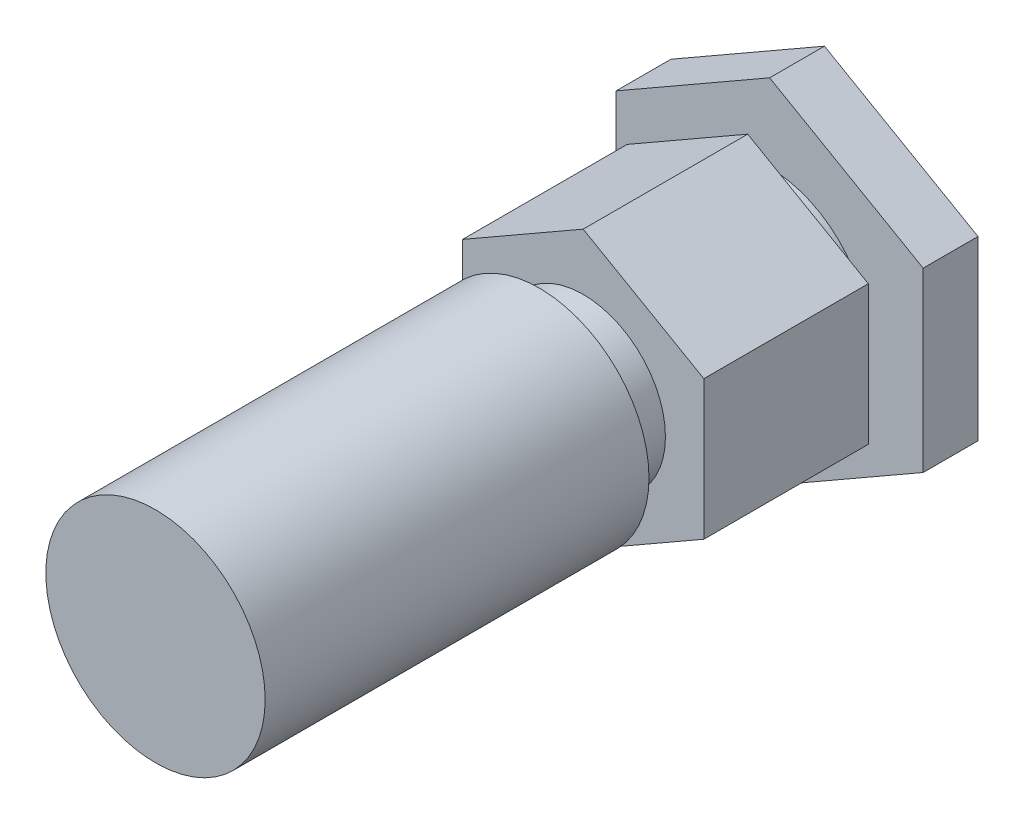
SolidWorks part; units mm, degrees
ref_plane "Plan de face" through (0, 0, 0) normal (0, 0, 1) x (1, 0, 0)
ref_plane "Plan de dessus" through (0, 0, 0) normal (0, 1, 0) x (1, 0, 0)
ref_plane "Plan de droite" through (0, 0, 0) normal (1, 0, 0) x (0, 0, -1)
sketch "Esquisse1" plane through (0, 0, 0) normal (0, 0, 1) x (1, 0, 0)
  line L0 (0, 0) -> (0, 43.8476) construction
  line L1 (0, 0) -> (39.2372, 0) construction
  line L2 (0, 16.1) -> (14, 8.0698)
  line L3 (14, 8.0698) -> (14, -8.0698)
  line L4 (0, -16.1) -> (14, -8.0698)
  line L5 (0, -16.1) -> (-14, -8.0698)
  line L6 (-14, 8.0698) -> (-14, -8.0698)
  line L7 (0, 16.1) -> (-14, 8.0698)
  circle A0 centre (0, 0) radius 8
  point P8 (14, 0)
  point P11 (-14, 0)
  dimension "D3" = 16
  dimension "D1" = 28
  dimension "D2" = 32.2
extrude "Extrusion1" add sketch "Esquisse1" along normal blind 5
sketch "Esquisse2" plane through (0, 0, 0) normal (0, 0, 1) x (1, 0, 0)
  circle A0 centre (0, 0) radius 9
  dimension "D1" = 18
extrude "Extrusion2" add sketch "Esquisse2" along normal blind 9 from offset 2
sketch "Esquisse3" plane through (0, 0, 7) normal (0, 0, 1) x (1, 0, 0)
  line L0 (0, 0) -> (0, 20.2617) construction
  line L1 (0, 0) -> (16.3785, 0) construction
  line L2 (0, 12.65) -> (11, 6.3405)
  line L3 (11, 6.3405) -> (11, -6.3405)
  line L4 (0, -12.65) -> (11, -6.3405)
  line L5 (0, -12.65) -> (-11, -6.3405)
  line L6 (-11, 6.3405) -> (-11, -6.3405)
  line L7 (0, 12.65) -> (-11, 6.3405)
  point P8 (11, 0)
  point P11 (-11, 0)
  dimension "D1" = 22
  dimension "D2" = 25.3
extrude "Extrusion3" add sketch "Esquisse3" along normal blind 15
sketch "Esquisse4" plane through (0, 0, 22) normal (0, 0, 1) x (1, 0, 0)
  circle A0 centre (0, 0) radius 7.5
  dimension "D1" = 15
extrude "Extru.-Mince1" add sketch "Esquisse4" along normal blind 4 thin
sketch "Esquisse5" plane through (0, 0, 26) normal (0, 0, 1) x (1, 0, 0)
  circle A0 centre (0, 0) radius 10
  dimension "D1" = 20
extrude "Extrusion4" add sketch "Esquisse5" along normal blind 35
